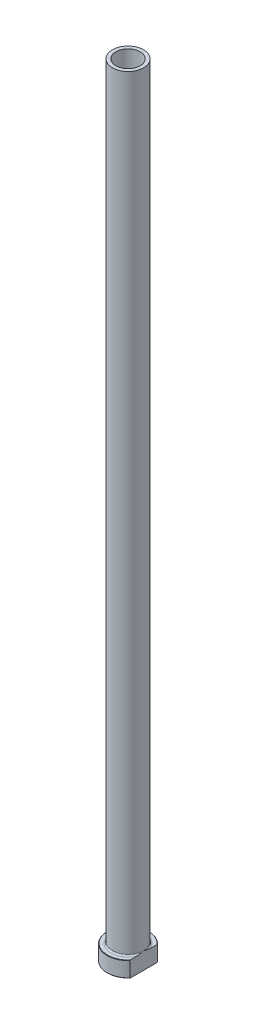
SolidWorks part; units mm, degrees
ref_plane "Front Plane" through (0, 0, 0) normal (0, 0, 1) x (1, 0, 0)
ref_plane "Top Plane" through (0, 0, 0) normal (0, 1, 0) x (1, 0, 0)
ref_plane "Right Plane" through (0, 0, 0) normal (1, 0, 0) x (0, 0, -1)
sketch "Sketch1" plane through (0, 0, 0) normal (0, 0, 1) x (1, 0, 0)
  line L0 (-7, 450) -> (-9, 450)
  line L1 (-9, 450) -> (-9, 9)
  line L2 (-9, 9) -> (-12, 9)
  line L3 (-12, 9) -> (-12, 0)
  line L4 (11.55, 0) -> (-11.55, 0) construction
  line L5 (-12, 0) -> (-7.25, 0)
  line L6 (-7, 395) -> (-7, 450)
  line L7 (0, 92.1877) -> (0, -15.5353) construction
  line L8 (0, -13.2) -> (0, 13.2) construction
  line L9 (-7, 395) -> (-7.25, 383)
  line L10 (-7.25, 383) -> (-7.25, 0)
  dimension "D1" = 0.25
  dimension "ID" = 14
  dimension "OD" = 18
  dimension "L" = 450
  dimension "H" = 24
  dimension "T" = 9
  dimension "N" = 55
  dimension "D2" = 12
  dimension "L-N" = 395
revolve "Revolve1" add sketch "Sketch1" angle 360 about L7
fillet "Fillet1" radius 0.8 1 edges at (0, 9, 9)
chamfer "Chamfer1" distance 0.2 angle 45 2 edges at (0, 9, 12) (0, 0, 12)
sketch "Sketch2" plane through (0, 0, 0) normal (0, -1, 0) x (1, 0, 0)
  line L0 (9, 7.9373) -> (9, -7.9373)
  circle A0 centre (0, 0) radius 12 construction
  arc A1 (9, 7.9373) -> (9, -7.9373) centre (0, 0) cw
  circle A2 centre (0, 0) radius 9 construction
extrude "Cut-Extrude1" cut sketch "Sketch2" against normal through all
chamfer "Chamfer2" distance 0.5 angle 45 1 edges at (0, 0, 7.25)
